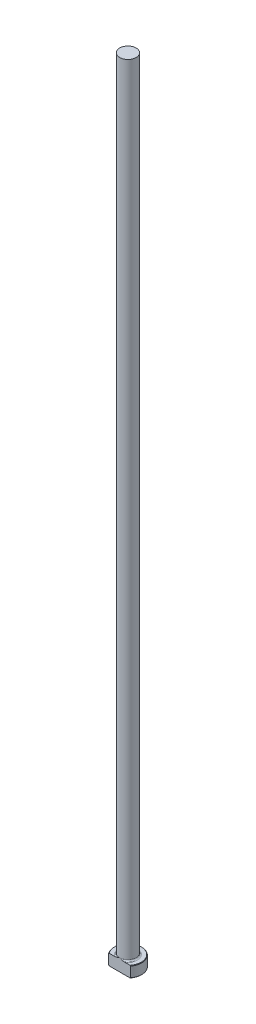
SolidWorks part; units mm, degrees
ref_plane "Front Plane" through (0, 0, 0) normal (0, 0, 1) x (1, 0, 0)
ref_plane "Top Plane" through (0, 0, 0) normal (0, 1, 0) x (1, 0, 0)
ref_plane "Right Plane" through (0, 0, 0) normal (1, 0, 0) x (0, 0, -1)
sketch "Sketch1" plane through (0, 0, 0) normal (0, 0, 1) x (1, 0, 0)
  line L0 (0, 259.9588) -> (0, -15.1925) construction
  line L1 (0, 0) -> (-7.9375, 0)
  line L2 (-7.9375, 0) -> (-7.9375, 6.35)
  line L3 (-7.9375, 6.35) -> (-4.7625, 6.35)
  line L4 (-4.7625, 6.35) -> (-4.7625, 457.2)
  line L5 (-4.7625, 457.2) -> (0, 457.2)
  line L6 (0, 457.2) -> (0, 0)
  dimension "L" = 457.2
  dimension "H" = 15.875
  dimension "T" = 6.35
  dimension "D" = 9.525
revolve "Revolve1" add sketch "Sketch1" angle 360 about L0
chamfer "Chamfer1" distance 0.254 angle 45 2 edges at (0, 6.35, 7.9375) (0, 0, 7.9375)
fillet "Fillet1" radius 0.762 1 edges at (0, 6.35, 4.7625)
sketch "Sketch2" plane through (0, 0, 0) normal (0, 1, 0) x (1, 0, 0)
  line L0 (-6.35, -4.7625) -> (6.35, -4.7625)
  circle A0 centre (0, 0) radius 7.9375 construction
  arc A1 (-6.35, -4.7625) -> (6.35, -4.7625) centre (0, 0) ccw
  circle A3 centre (0, 0) radius 4.7625 construction
  dimension "D1" = 0
extrude "Key" cut sketch "Sketch2" along normal through all
sketch "Pocket Sketch" plane through (0, 0, 0) normal (0, 0, 1) x (1, 0, 0)
  line L0 (-8.3344, 0) -> (-8.3344, 6.3754)
  line L1 (-8.3344, 6.3754) -> (-5.9214, 6.3754)
  line L2 (-5.1594, 7.1374) -> (-5.1594, 22.225)
  line L3 (-5.1594, 22.225) -> (0, 22.225)
  line L4 (0, 22.225) -> (0, 0)
  line L5 (0, 0) -> (-8.3344, 0)
  line L6 (0, 12.6104) -> (0, -2.4989) construction
  line L7 (-7.9375, 6.096) -> (-7.9375, 0.254) construction
  line L8 (7.6835, 6.35) -> (-7.6835, 6.35) construction
  line L9 (-4.7625, 457.2) -> (-4.7625, 7.112) construction
  line L10 (-5.9214, 6.3754) -> (-5.1594, 7.1374)
  point P3 (-5.1594, 6.3754)
  dimension "D1" = 16.6687
  dimension "D2" = 0.3969
  dimension "D3" = 0.0254
  dimension "D4" = 0.3969
  dimension "D5" = 10.3187
  dimension "D6" = 22.225
